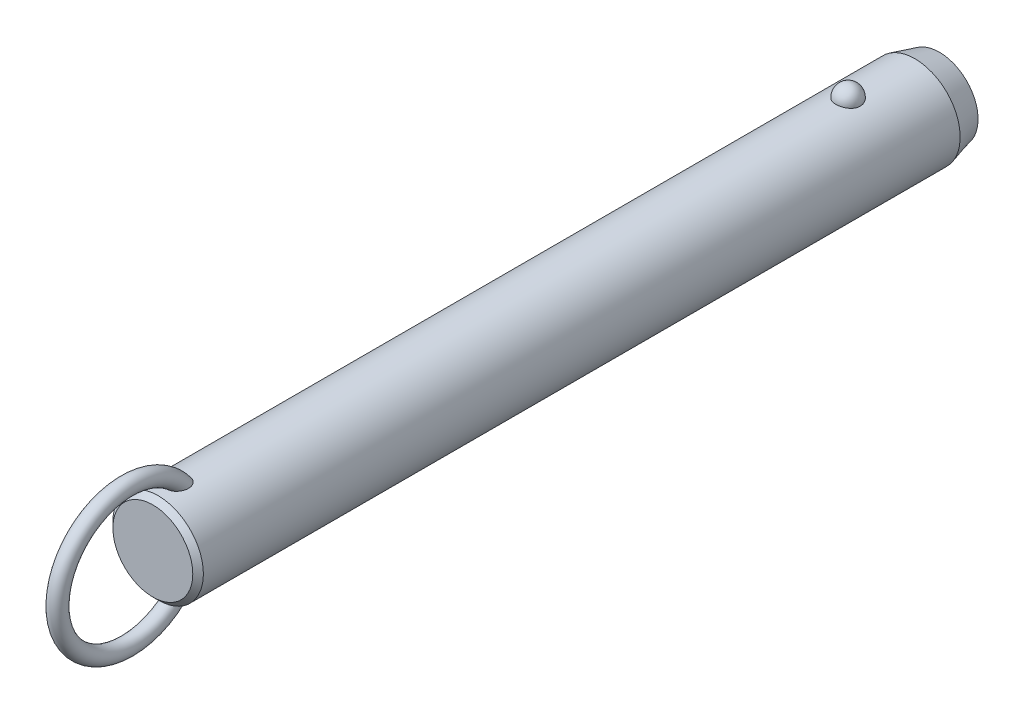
SolidWorks part; units mm, degrees
ref_plane "Front Plane" through (0, 0, 0) normal (0, 0, 1) x (1, 0, 0)
ref_plane "Top Plane" through (0, 0, 0) normal (0, 1, 0) x (1, 0, 0)
ref_plane "Right Plane" through (0, 0, 0) normal (1, 0, 0) x (0, 0, -1)
sketch "Sketch2" plane through (0, 0, 0) normal (0, 0, 1) x (1, 0, 0)
  circle A0 centre (0, 0) radius 11.1
  point P3 (0, 11.1)
  dimension "D1" = 22.2
extrude "Boss-Extrude1" add sketch "Sketch2" along normal blind 154.9
sketch "Sketch3" plane through (0, 0, 0) normal (0, 0, -1) x (-1, 0, 0)
  circle A0 centre (0, 0) radius 11.1
  dimension "D1" = 22.2
extrude "Boss-Extrude2" add sketch "Sketch3" along normal blind 25.4
chamfer "Chamfer1" distance 6 angle 15 1 edges at (-11.1, 0, -25.4)
sketch "Sketch12" plane through (0, 0, 0) normal (1, 0, 0) x (0, 0, -1)
  line L0 (-154.9, 11.1) -> (-154.9, -11.1) construction
  point P0 (-154.9, 0)
sketch "Sketch13" plane through (0, 0, 0) normal (1, 0, 0) x (0, 0, -1)
  circle A0 centre (-173.95, 0) radius 19.05
  point P2 (-154.9, 0)
  dimension "D1" = 38.1
sketch "Sketch14" plane through (0, 0, 0) normal (0, 1, 0) x (1, 0, 0)
  circle A0 centre (0, -156.9) radius 2
  point P2 (0, -154.9)
  dimension "D1" = 4
sweep "Sweep1" add profiles "Sketch14" path "Sketch13"
sketch "Sketch15" plane through (0, 0, 154.9) normal (0, 0, 1) x (1, 0, 0)
  circle A0 centre (0, 0) radius 11.1
  dimension "D1" = 22.2
extrude "Boss-Extrude3" add sketch "Sketch15" along normal blind 12.7
chamfer "Chamfer2" distance 1.3 angle 45 1 edges at (11.1, 0, 167.6)
sketch "Sketch18" plane through (0, 0, 0) normal (1, 0, 0) x (0, 0, -1)
  line L0 (19.4, 11.1) -> (-158.468, 11.1) construction
  line L1 (3, 14.1) -> (3, 8.1)
  line L2 (-158.468, -11.1) -> (19.4, -11.1) construction
  arc A0 (3, 14.1) -> (3, 8.1) centre (3, 11.1) ccw
  point P4 (0, 11.1)
  dimension "D1" = 25.2
revolve "Revolve1" add sketch "Sketch18" angle 360 about L1
